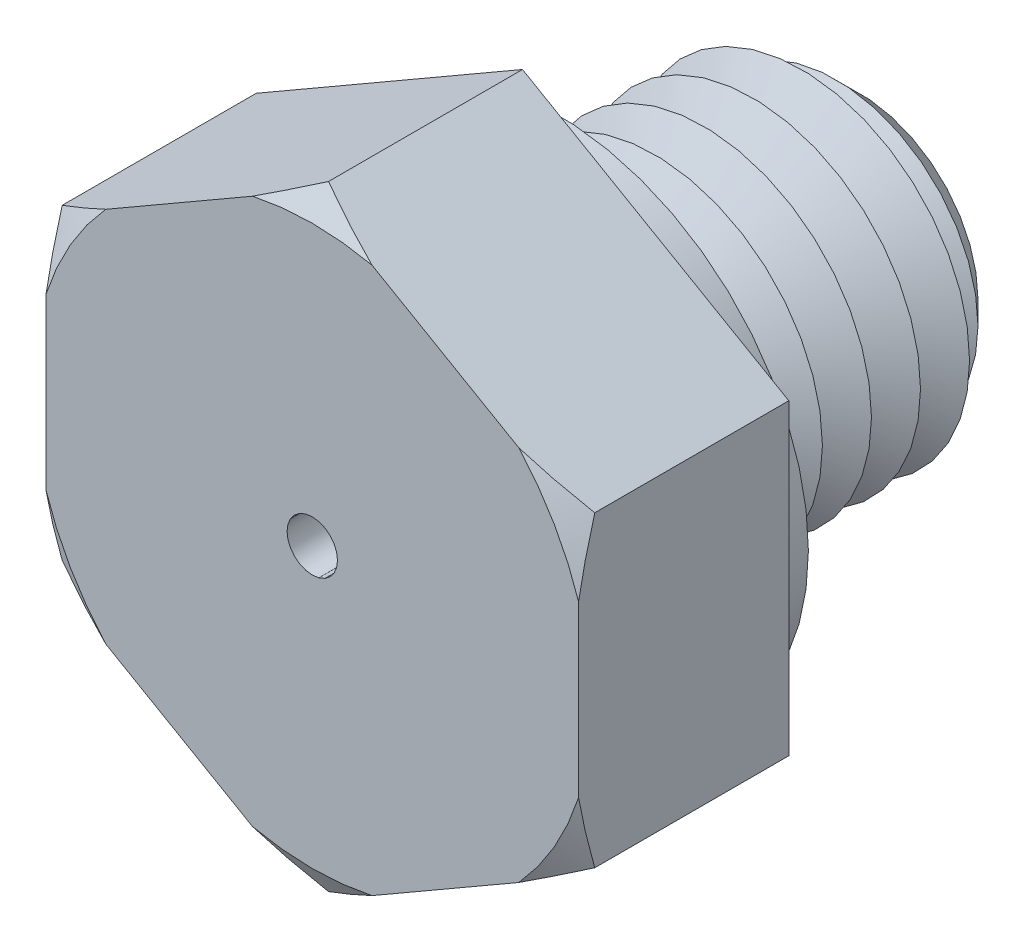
SolidWorks part; units mm, degrees
ref_plane "Front Plane" through (0, 0, 0) normal (0, 0, 1) x (1, 0, 0)
ref_plane "Top Plane" through (0, 0, 0) normal (0, 1, 0) x (1, 0, 0)
ref_plane "Right Plane" through (0, 0, 0) normal (1, 0, 0) x (0, 0, -1)
sketch "Sketch2" plane through (0, 0, 0) normal (0, 0, 1) x (1, 0, 0)
  line L1 (0, 10.9697) -> (-9.5, 5.4848)
  line L2 (-9.5, 5.4848) -> (-9.5, -5.4848)
  line L3 (-9.5, -5.4848) -> (0, -10.9697)
  line L4 (0, -10.9697) -> (9.5, -5.4848)
  line L5 (9.5, -5.4848) -> (9.5, 5.4848)
  line L6 (9.5, 5.4848) -> (0, 10.9697)
  circle A0 centre (0, 0) radius 9.5 construction
  dimension "D1" = 19
extrude "Boss-Extrude1" add sketch "Sketch2" along normal blind 7.5
sketch "Sketch3" plane through (0, 0, 0) normal (0, 0, -1) x (-1, 0, 0)
  circle A0 centre (0, 0) radius 6
  dimension "D1" = 12
extrude "Boss-Extrude2" add sketch "Sketch3" along normal blind 12
sketch "Sketch4" plane through (0, 0, 0) normal (0, 0, -1) x (-1, 0, 0)
  circle A0 centre (0, 0) radius 9
  dimension "D1" = 18
extrude "Boss-Extrude3" add sketch "Sketch4" along normal blind 1.2
sketch "Sketch5" plane through (0, 0, 0) normal (1, 0, 0) x (0, 0, -1)
  line L0 (-3.2117, 0) -> (6.3192, 0) construction
chamfer "Chamfer1" distance 1.75 angle 45 1 edges at (-6, 0, -12)
sketch "Sketch6" plane through (0, 0, 0) normal (1, 0, 0) x (0, 0, -1)
  line L0 (1.2, 6) -> (2.075, 4.4845)
  line L1 (2.075, 4.4845) -> (2.95, 6)
  line L2 (10.25, 6) -> (1.2, 6) construction
  line L3 (2.95, 6) -> (1.2, 6)
  dimension "D1" = 1.75
revolve "Cut-Revolve1" cut sketch "Sketch6" angle 360 about L0
pattern_linear "LPattern1" count 6 spacing 1.75 along (0, 0, -1) of "Cut-Revolve1"
sketch "Sketch7" plane through (0, 0, 0) normal (1, 0, 0) x (0, 0, -1)
  line L0 (-7.5, 10.9697) -> (-7.5, 9.9697)
  line L1 (-7.5, 5.4848) -> (-7.5, 10.9697) construction
  line L2 (-7.5, 9.9697) -> (-6.9226, 10.9697)
  line L3 (-7.5, 10.9697) -> (0, 10.9697) construction
  line L4 (-6.9226, 10.9697) -> (-7.5, 10.9697)
  dimension "D1" = 1
  dimension "D2" = 30
revolve "Cut-Revolve2" cut sketch "Sketch7" angle 360 about L0
sketch "Sketch8" plane through (0, 0, 7.5) normal (0, 0, 1) x (1, 0, 0)
  circle A0 centre (0, 0) radius 0.9
  dimension "D1" = 1.8
extrude "Cut-Extrude1" cut sketch "Sketch8" against normal up to surface (19.5 mm away)
